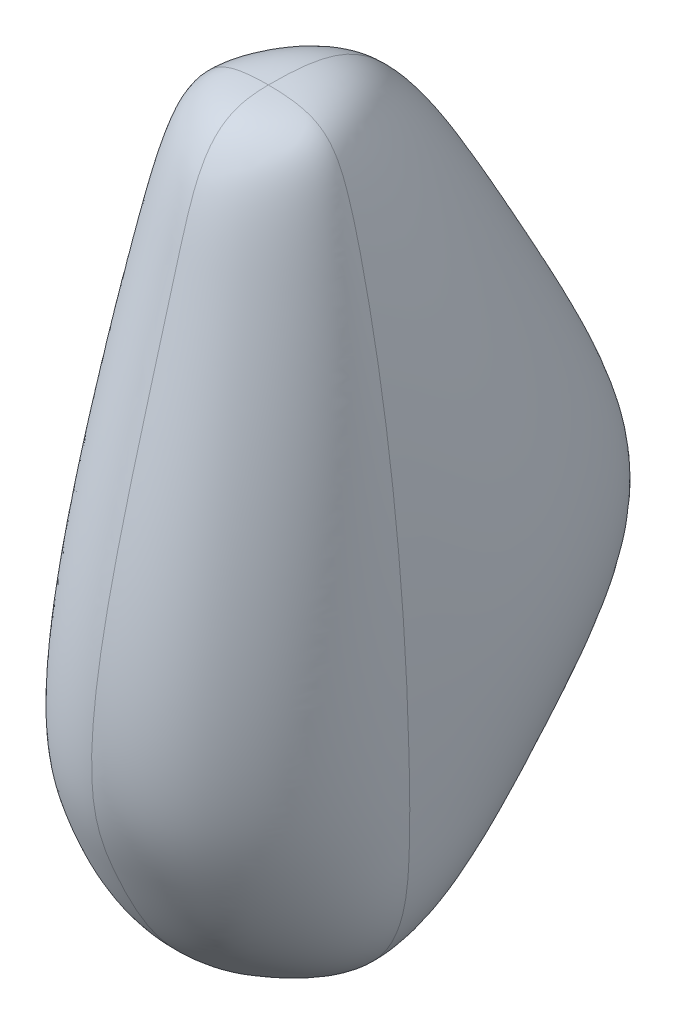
SolidWorks part; units mm, degrees
ref_plane "Front Plane" through (0, 0, 0) normal (0, 0, 1) x (1, 0, 0)
ref_plane "Top Plane" through (0, 0, 0) normal (0, 1, 0) x (1, 0, 0)
ref_plane "Right Plane" through (0, 0, 0) normal (1, 0, 0) x (0, 0, -1)
imported_body "Stock-form_06-02_with base-1"
sketch "Sketch3" plane through (0, 0, 0) normal (1, 0, 0) x (0, 0, -1)
  line L0 (0, 0) -> (2.9716, 48.4442)
  line L1 (0, 254) -> (0, 0)
  spline S1 degree 3 poles (-83.4482, -2993.5072) (-152.3232, 85.3594) (-77.1326, -3.8071) (9.3423, 0.2393) (14.0227, 0.7905) (18.656, 1.7658) (23.1987, 3.1657) (27.632, 4.927) (31.9592, 6.9713) (36.1943, 9.2313) (40.353, 11.6552) (44.4492, 14.2057) (48.4951, 16.8541) (53.8331, 20.4909) (60.4207, 25.1898) (68.2216, 30.9951) (75.9457, 36.9014) (83.5825, 42.8987) (90.9984, 49.1247) (96.8754, 54.6078) (101.2559, 59.2763) (104.3116, 62.9605) (107.0833, 66.8439) (109.5062, 70.9341) (111.5143, 75.2231) (113.0504, 79.6816) (114.0826, 84.2603) (114.4373, 87.3529) (114.6847, 91.1758) (114.6452, 95.7381) (113.7656, 102.4936) (112.2642, 109.111) (110.3023, 115.582) (108.0031, 121.9189) (105.4547, 128.14) (102.7225, 134.2646) (98.8946, 142.3246) (93.8559, 152.2404) (87.5836, 163.9786) (82.2544, 173.6817) (77.9617, 181.4207) (74.7333, 187.2184) (71.488, 193.0067) (68.2136, 198.7803) (64.8986, 204.5342) (61.5268, 210.2604) (58.0776, 215.9477) (54.5153, 221.5742) (50.7912, 227.1068) (46.8436, 232.4967) (42.5826, 237.6615) (37.8877, 242.4614) (32.6235, 246.6688) (26.7204, 249.9765) (20.3042, 252.1796) (13.6206, 253.3948) (-99.4478, 262.2109) (-226.7691, 104.8232) (-77.183, 3241.9169) knots -0.662594 -0.662594 -0.662594 -0.662594 0.012646 0.025292 0.037938 0.050583 0.063229 0.075875 0.088521 0.101167 0.113813 0.126459 0.139104 0.15175 0.177042 0.202334 0.227625 0.252917 0.278209 0.3035 0.316146 0.328792 0.341438 0.354084 0.36673 0.379376 0.392021 0.404667 0.404667 0.423271 0.441876 0.46048 0.479084 0.497688 0.516292 0.534896 0.5535 0.590709 0.627917 0.665125 0.683729 0.702334 0.720938 0.739542 0.758146 0.77675 0.795354 0.813959 0.832563 0.851167 0.869771 0.888375 0.906979 0.925583 0.944188 0.962792 0.981396 1.873928 1.873928 1.873928 1.873928 only from (0, 0) to (0, 254)
  spline S2 degree 3 poles (0, 0) (1.5503, 0) (4.6592, 0.0202) (9.3423, 0.2393) (14.0227, 0.7905) (18.656, 1.7658) (23.1987, 3.1657) (27.632, 4.927) (31.9592, 6.9713) (36.1943, 9.2313) (40.353, 11.6552) (44.4492, 14.2057) (48.4951, 16.8541) (53.8331, 20.4909) (60.4207, 25.1898) (68.2216, 30.9951) (75.9457, 36.9014) (83.5825, 42.8987) (90.9984, 49.1247) (96.8754, 54.6078) (101.2559, 59.2763) (104.3116, 62.9605) (107.0833, 66.8439) (109.5062, 70.9341) (111.5143, 75.2231) (113.0504, 79.6816) (114.0826, 84.2603) (114.4373, 87.3529) (114.6847, 91.1758) (114.6452, 95.7381) (113.7656, 102.4936) (112.2642, 109.111) (110.3023, 115.582) (108.0031, 121.9189) (105.4547, 128.14) (102.7225, 134.2646) (98.8946, 142.3246) (93.8559, 152.2404) (87.5836, 163.9786) (82.2544, 173.6817) (77.9617, 181.4207) (74.7333, 187.2184) (71.488, 193.0067) (68.2136, 198.7803) (64.8986, 204.5342) (61.5268, 210.2604) (58.0776, 215.9477) (54.5153, 221.5742) (50.7912, 227.1068) (46.8436, 232.4967) (42.5826, 237.6615) (37.8877, 242.4614) (32.6235, 246.6688) (26.7204, 249.9765) (20.3042, 252.1796) (13.6206, 253.3948) (6.8331, 253.9241) (2.2805, 254) (0, 254) knots 0 0 0 0 0.012646 0.025292 0.037938 0.050583 0.063229 0.075875 0.088521 0.101167 0.113813 0.126459 0.139104 0.15175 0.177042 0.202334 0.227625 0.252917 0.278209 0.3035 0.316146 0.328792 0.341438 0.354084 0.36673 0.379376 0.392021 0.404667 0.404667 0.423271 0.441876 0.46048 0.479084 0.497688 0.516292 0.534896 0.5535 0.590709 0.627917 0.665125 0.683729 0.702334 0.720938 0.739542 0.758146 0.77675 0.795354 0.813959 0.832563 0.851167 0.869771 0.888375 0.906979 0.925583 0.944188 0.962792 0.981396 1 1 1 1
  point P0 (0, 0)
  line B0 (2.9716, 48.4442) -> (-2.9716, -48.4442) construction
  line B1 (49.8233, -3.0562) -> (-49.8233, 3.0562) construction
  spline B2 degree 3 poles (0, 0) (-1.8319, 0) (-5.4946, 0.1797) (-10.9194, 1.0757) (-16.1816, 2.6602) (-21.1777, 4.9441) (-25.82, 7.8699) (-31.4849, 12.497) (-36.3592, 17.9676) (-40.5982, 23.9065) (-43.5142, 28.5433) (-46.2048, 33.3114) (-48.7137, 38.1818) (-51.0659, 43.1313) (-52.9287, 47.3045) (-54.3492, 50.6754) (-55.6938, 54.0791) (-56.6035, 56.6718) (-57.8228, 60.5648) (-58.6973, 63.8246) (-59.5448, 68.2419) (-60.0158, 71.5822) (-60.3407, 74.94) (-60.6012, 79.4308) (-60.6409, 85.0559) (-60.327, 91.7987) (-59.724, 98.5221) (-58.8874, 105.221) (-57.8601, 111.8939) (-56.6761, 118.5413) (-55.3624, 125.1648) (-53.9411, 131.7665) (-52.4305, 138.3488) (-50.8458, 144.914) (-49.2001, 151.4644) (-47.5046, 158.0022) (-45.7692, 164.5297) (-44.0023, 171.0487) (-42.212, 177.5611) (-40.4049, 184.0688) (-38.5882, 190.5735) (-36.7667, 197.0765) (-34.9479, 203.5798) (-33.1338, 210.0838) (-31.6367, 215.5073) (-30.4332, 219.8442) (-29.5092, 223.0906) (-28.5539, 226.3278) (-27.5487, 229.5497) (-26.4742, 232.7491) (-25.3006, 235.9135) (-23.9875, 239.0231) (-22.465, 242.037) (-20.6746, 244.9017) (-18.5532, 247.5346) (-16.0506, 249.8145) (-13.1764, 251.6079) (-10.0268, 252.8483) (-6.7288, 253.5872) (-3.3718, 253.9418) (-1.1238, 254) (0, 254) knots 0 0 0 0 0.018096 0.036193 0.054289 0.072386 0.090482 0.108578 0.144771 0.162868 0.180964 0.19906 0.217157 0.235253 0.253349 0.262398 0.271446 0.289542 0.289542 0.311744 0.322845 0.333946 0.345047 0.356148 0.378349 0.400551 0.422753 0.444955 0.467157 0.489358 0.51156 0.533762 0.555964 0.578166 0.600368 0.622569 0.644771 0.666973 0.689175 0.711377 0.733578 0.75578 0.777982 0.800184 0.822386 0.833486 0.844587 0.855688 0.866789 0.87789 0.888991 0.900092 0.911193 0.922294 0.933395 0.944495 0.955596 0.966697 0.977798 0.988899 1 1 1 1
  spline B3 degree 3 number of poles 227 (67.8362, -55.5713) -> (-103.0279, 1.6034)
  spline B4 degree 3 poles (-102.8621, 1.5436) (-102.2055, 1.3191) (-100.4394, 0.7213) (-97.2919, -0.3398) (-94.6296, -1.2361) (-91.7559, -2.2027) (-88.7145, -3.225) (-85.546, -4.2896) (-81.1818, -5.7553) (-75.5174, -7.6568) (-68.4838, -10.0167) (-61.2741, -12.4348) (-53.9289, -14.8975) (-46.4772, -17.3952) (-38.9412, -19.9205) (-31.3386, -22.4674) (-23.6856, -25.0306) (-15.996, -27.6054) (-8.2859, -30.1863) (-0.5672, -32.7695) (4.5685, -34.4873) (8.7949, -35.9006) (12.1293, -37.0153) (17.041, -38.6566) (21.847, -40.2619) (26.5462, -41.8309) (31.1344, -43.3623) (35.6078, -44.8549) (39.9587, -46.3061) (44.1765, -47.7124) (48.2447, -49.0682) (52.1397, -50.3656) (55.8268, -51.593) (59.2541, -52.733) (62.3444, -53.7596) (64.9761, -54.6322) (66.9656, -55.2893) (67.681, -55.5225) (67.8362, -55.5713) knots 0 0 0 0 0.037702 0.056554 0.075405 0.094256 0.113107 0.131959 0.15081 0.188512 0.226215 0.263917 0.30162 0.339322 0.377025 0.414727 0.452429 0.490132 0.527834 0.565537 0.603239 0.603239 0.628037 0.652834 0.677632 0.702429 0.727227 0.752025 0.776822 0.80162 0.826417 0.851215 0.876012 0.90081 0.925607 0.950405 0.975202 1 1 1 1
sketch_block_instance "Block2-2"
sketch_block "Block2"
sketch_block_instance "Block2-1"
sketch_block "Block2" parameters "D1"=0
ref_plane "Plane2" through (0, 0, 0) normal (0, 0.9981, -0.0612) x (0, 0.0612, 0.9981)
sketch "Sketch4" plane through (0, 0, 0) normal (0, 0.9981, -0.0612) x (0, 0.0612, 0.9981)
  circle A0 centre (0, 0) radius 5
  dimension "D1" = 10
extrude "Cut-Extrude2" cut sketch "Sketch4" against normal mid plane 30
